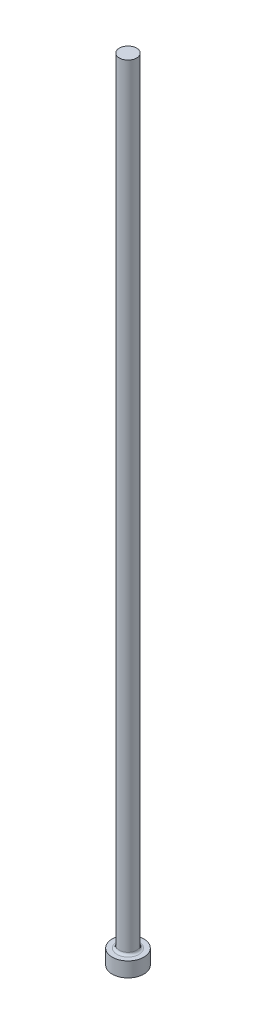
SolidWorks part; units mm, degrees
ref_plane "Front Plane" through (0, 0, 0) normal (0, 0, 1) x (1, 0, 0)
ref_plane "Top Plane" through (0, 0, 0) normal (0, 1, 0) x (1, 0, 0)
ref_plane "Right Plane" through (0, 0, 0) normal (1, 0, 0) x (0, 0, -1)
sketch "Sketch1" plane through (0, 0, 0) normal (0, 0, 1) x (1, 0, 0)
  line L0 (0, 0) -> (5.08, 0)
  line L1 (55, 0) -> (-55, 0) construction
  line L2 (5.08, 0) -> (5.08, 4.7498)
  line L3 (5.08, 4.7498) -> (3.5395, 4.7498)
  line L4 (2.7775, 5.5118) -> (2.7775, 254)
  line L5 (2.7775, 254) -> (0, 254)
  line L6 (0, 254) -> (0, 0)
  arc A0 (3.5395, 4.7498) -> (2.7775, 5.5118) centre (3.5395, 5.5118) cw
  dimension "D5" = 0.762
  dimension "D1" = 2.7775
  dimension "D2" = 5.08
  dimension "D3" = 4.7498
  dimension "D4" = 254
revolve "Revolve1" add sketch "Sketch1" angle 360 about L6
